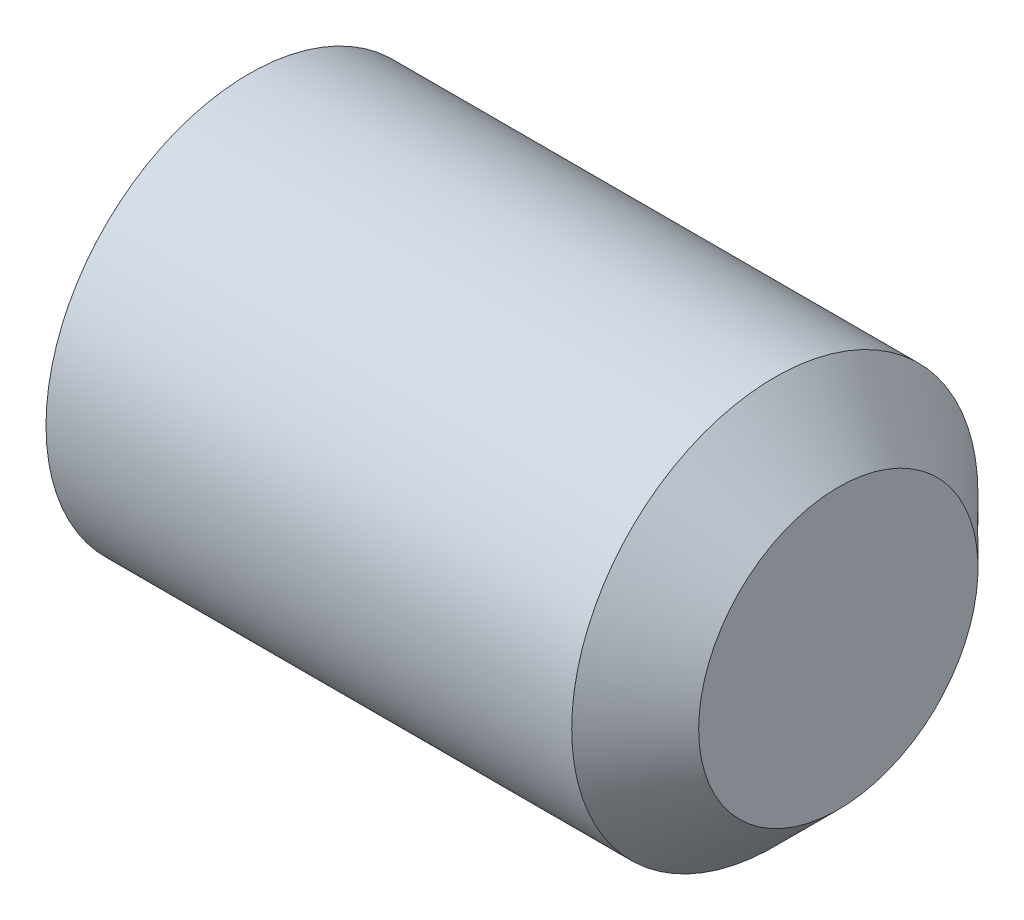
SolidWorks part; units mm, degrees
ref_plane "Plane1" through (0, 0, 0) normal (0, 0, 1) x (1, 0, 0)
ref_plane "Plane2" through (0, 0, 0) normal (0, 1, 0) x (1, 0, 0)
ref_plane "Plane3" through (0, 0, 0) normal (1, 0, 0) x (0, 0, -1)
sketch "BodySke" plane through (0, 0, 0) normal (0, 0, 1) x (1, 0, 0)
  line L0 (0, 0) -> (0, 3.3095)
  line L1 (0, 3.3095) -> (0.3987, 4)
  line L2 (0.3987, 4) -> (10.75, 4)
  line L3 (10.75, 4) -> (12, 2.75)
  line L4 (12, 0) -> (0, 0)
  line L5 (-12.7, 0) -> (88.9, 0) construction
  line L6 (12, 2.75) -> (12, 0)
  line L7 (12, 2.75) -> (12, 12.275) construction
  line L8 (0, -3.3095) -> (0.3987, -4) construction
  line L9 (1.25, 15.875) -> (1.25, -3.175) construction
  line L10 (10.75, -4) -> (12, -2.75) construction
  dimension "Length" = 12
  dimension "Diameter" = 8
  dimension "Drive_ch_ang" = 60
  dimension "Minor_dia" = 6.619
  dimension "Cup_nose_ang" = 45
  dimension "Cup_dia" = 5.5
  dimension "Advance" = 1.25
revolve "BaseBody" add sketch "BodySke" angle 360 about L5
sketch "Sketch2" plane through (0, 0, 0) normal (-1, 0, 0) x (0, 0, 1)
  line L0 (1.1547, 2) -> (-1.1547, 2)
  line L1 (-1.1547, 2) -> (-2.3094, 0)
  line L2 (1.1547, 2) -> (2.3094, 0)
  line L3 (1.1547, -2) -> (2.3094, 0)
  line L4 (1.1547, -2) -> (-1.1547, -2)
  line L5 (-1.1547, -2) -> (-2.3094, 0)
  dimension "Hex_size" = 4
  dimension "D2" = 2
  dimension "D3" = 2
extrude "Hex" cut sketch "Sketch2" against normal blind 5
sketch "ThdSchSke" plane through (0, 0, 0) normal (0, 0, 1) x (1, 0, 0)
  line L0 (0.3987, -3.3095) -> (-0.0848, -4)
  line L1 (0.3987, -3.3095) -> (0.8822, -4)
  line L2 (0.8822, -4) -> (0.8822, -5)
  line L3 (-3.175, 0) -> (5.1513, 0) construction
  line L5 (0.8822, -5) -> (-0.0848, -5)
  line L6 (-0.0848, -5) -> (-0.0848, -4)
  line L8 (0.3987, 4) -> (0.3987, -4) construction
  dimension "Thread_minor" = 6.619
  dimension "Diameter" = 8
  dimension "SideAngle" = 55
  dimension "VeeAngle" = 70
  dimension "Overcut" = 10
revolve "ThreadSchematic" [suppressed] cut sketch "ThdSchSke" angle 360 about L3
pattern_linear "ThdSchPat" [suppressed]
equation "\"D2@Sketch2\" = \"Hex_size@Sketch2\" / 2"
equation "\"D3@Sketch2\" = \"Hex_size@Sketch2\" / 2"
equation "\"Thread_minor@ThreadCosmetic\" = \"Minor_dia@BodySke\""
equation "\"Thread_minor@ThdSchSke\" = \"Thread_minor@ThreadCosmetic\""
equation "\"Diameter@ThdSchSke\" = \"Diameter@BodySke\""
equation "\"Overcut@ThdSchSke\" = \"Diameter@BodySke\" * 1.25"
equation "\"Num_threads@ThdSchPat\" = int( (\"Length@BodySke\" - ( ( ( \"Diameter@BodySke\" - \"Minor_dia@BodySke\" ) * 0.5 ) / tan( \"Drive_ch_ang@BodySke\" * 0.017453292 ) ) - ( ( ( \"Diameter@BodySke\" - \"Cup_dia@BodySk"
equation "\"Advance@ThdSchPat\" = (\"Length@BodySke\" - ( ( ( \"Diameter@BodySke\" - \"Minor_dia@BodySke\" ) * 0.5 ) / tan( \"Drive_ch_ang@BodySke\" * 0.017453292 ) ) - ( ( ( \"Diameter@BodySke\" - \"Cup_dia@BodySke\" ) * 0."
equation "' \"Num_threads@ThdSchPat\" = \"Num_threads@ThdSchPat\" - sgn( \"Num_threads@ThdSchPat\" - 1) '---chamfered tips only---"
